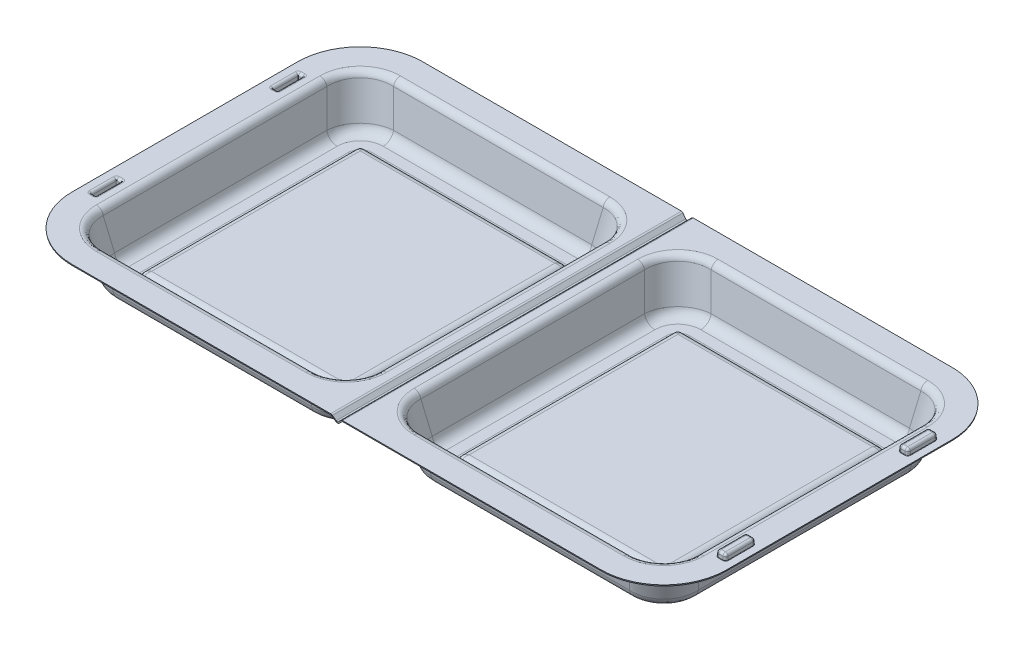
SolidWorks part; units mm, degrees
ref_plane "Front Plane" through (0, 0, 0) normal (0, 0, 1) x (1, 0, 0)
ref_plane "Top Plane" through (0, 0, 0) normal (0, 1, 0) x (1, 0, 0)
ref_plane "Right Plane" through (0, 0, 0) normal (1, 0, 0) x (0, 0, -1)
sketch "Sketch1" plane through (0, 0, 0) normal (0, 1, 0) x (1, 0, 0)
  line L0 (10.16, 80.01) -> (10.16, -80.01)
  line L1 (10.16, 80.01) -> (162.56, 80.01)
  line L2 (162.56, 80.01) -> (162.56, -80.01)
  line L3 (162.56, -80.01) -> (10.16, -80.01)
  line L4 (0, 0) -> (10.16, 0)
  dimension "D1" = 152.4
  dimension "D2" = 160.02
  dimension "D3" = 10.16
extrude "Boss-Extrude1" add sketch "Sketch1" against normal blind 25.4 draft 10 contours L3 L2 L1 L0
fillet "Fillet1" radius 19.05 4 edges at (12.3994, -12.7, 77.7706) (160.3206, -12.7, 77.7706) (160.3206, -12.7, -77.7706) (12.3994, -12.7, -77.7706)
fillet "Fillet2" radius 6.35 8 edges at (20.0997, -25.4, 70.0703) (152.6203, -25.4, 70.0703) (152.6203, -25.4, -70.0703) (20.0997, -25.4, -70.0703) (14.6387, -25.4, 0) (86.36, -25.4, -75.5313) (158.0813, -25.4, 0) (86.36, -25.4, 75.5313)
sketch "Sketch2" plane through (0, -25.4, 0) normal (0, -1, 0) x (1, 0, 0)
  line L8 (32.474, -60.043) -> (140.246, -60.043)
  line L9 (142.593, -57.696) -> (142.593, 57.696)
  line L10 (140.246, 60.043) -> (32.474, 60.043)
  line L11 (30.127, 57.696) -> (30.127, -57.696)
  line L12 (32.474, -60.043) -> (140.246, -60.043)
  line L13 (142.593, -57.696) -> (142.593, 57.696)
  line L14 (140.246, 60.043) -> (32.474, 60.043)
  line L15 (30.127, 57.696) -> (30.127, -57.696)
  spline S0 degree 3 poles (-3932.0247, -594.1817) (747.7764, 130.1973) (23.9409, -23.2816) (30.1943, -58.3085) (30.2357, -58.4592) (30.3472, -58.7486) (30.4164, -58.8857) (30.5826, -59.1443) (30.6811, -59.2671) (30.8994, -59.4859) (31.0191, -59.5826) (31.2793, -59.7509) (31.4193, -59.8217) (48.0334, -66.2502) (141.7104, 114.1395) (-3962.9018, -15.2075) knots -28.65324 -28.65324 -28.65324 -28.65324 0.125 0.125 0.25 0.25 0.375 0.375 0.5 0.5 0.625 0.625 0.75 0.75 15.062828 15.062828 15.062828 15.062828 only from (30.127, -57.696) to (32.474, -60.043)
  spline S1 degree 3 poles (676.7317, -4022.1947) (-47.6473, 657.6064) (105.8316, -66.2291) (140.8585, -59.9757) (141.0092, -59.9343) (141.2986, -59.8228) (141.4357, -59.7536) (141.6943, -59.5874) (141.8171, -59.4889) (142.0359, -59.2706) (142.1326, -59.1509) (142.3009, -58.8907) (142.3717, -58.7507) (148.8002, -42.1366) (-31.5895, 51.5404) (97.7575, -4053.0718) knots -28.65324 -28.65324 -28.65324 -28.65324 0.125 0.125 0.25 0.25 0.375 0.375 0.5 0.5 0.625 0.625 0.75 0.75 15.062828 15.062828 15.062828 15.062828 only from (140.246, -60.043) to (142.593, -57.696)
  spline S2 degree 3 poles (4104.7447, 594.1817) (-575.0564, -130.1973) (148.7791, 23.2816) (142.5257, 58.3085) (142.4843, 58.4592) (142.3728, 58.7486) (142.3036, 58.8857) (142.1374, 59.1443) (142.0389, 59.2671) (141.8206, 59.4859) (141.7009, 59.5826) (141.4407, 59.7509) (141.3007, 59.8217) (124.6866, 66.2502) (31.0096, -114.1395) (4135.6218, 15.2075) knots -28.65324 -28.65324 -28.65324 -28.65324 0.125 0.125 0.25 0.25 0.375 0.375 0.5 0.5 0.625 0.625 0.75 0.75 15.062828 15.062828 15.062828 15.062828 only from (142.593, 57.696) to (140.246, 60.043)
  spline S3 degree 3 poles (-504.0117, 4022.1947) (220.3673, -657.6064) (66.8884, 66.2291) (31.8615, 59.9757) (31.7108, 59.9343) (31.4214, 59.8228) (31.2843, 59.7536) (31.0257, 59.5874) (30.9029, 59.4889) (30.6841, 59.2706) (30.5874, 59.1509) (30.4191, 58.8907) (30.3483, 58.7507) (23.9198, 42.1366) (204.3095, -51.5404) (74.9625, 4053.0718) knots -28.65324 -28.65324 -28.65324 -28.65324 0.125 0.125 0.25 0.25 0.375 0.375 0.5 0.5 0.625 0.625 0.75 0.75 15.062828 15.062828 15.062828 15.062828 only from (32.474, 60.043) to (30.127, 57.696)
  spline S4 degree 3 poles (30.127, -57.696) (30.127, -57.8518) (30.1403, -58.0056) (30.1943, -58.3085) (30.2357, -58.4592) (30.3472, -58.7486) (30.4164, -58.8857) (30.5826, -59.1443) (30.6811, -59.2671) (30.8994, -59.4859) (31.0191, -59.5826) (31.2793, -59.7509) (31.4193, -59.8217) (31.8508, -59.9887) (32.162, -60.043) (32.474, -60.043) knots 0 0 0 0 0.125 0.125 0.25 0.25 0.375 0.375 0.5 0.5 0.625 0.625 0.75 0.75 1 1 1 1
  spline S5 degree 3 poles (140.246, -60.043) (140.4018, -60.043) (140.5556, -60.0297) (140.8585, -59.9757) (141.0092, -59.9343) (141.2986, -59.8228) (141.4357, -59.7536) (141.6943, -59.5874) (141.8171, -59.4889) (142.0359, -59.2706) (142.1326, -59.1509) (142.3009, -58.8907) (142.3717, -58.7507) (142.5387, -58.3192) (142.593, -58.008) (142.593, -57.696) knots 0 0 0 0 0.125 0.125 0.25 0.25 0.375 0.375 0.5 0.5 0.625 0.625 0.75 0.75 1 1 1 1
  spline S6 degree 3 poles (142.593, 57.696) (142.593, 57.8518) (142.5797, 58.0056) (142.5257, 58.3085) (142.4843, 58.4592) (142.3728, 58.7486) (142.3036, 58.8857) (142.1374, 59.1443) (142.0389, 59.2671) (141.8206, 59.4859) (141.7009, 59.5826) (141.4407, 59.7509) (141.3007, 59.8217) (140.8692, 59.9887) (140.558, 60.043) (140.246, 60.043) knots 0 0 0 0 0.125 0.125 0.25 0.25 0.375 0.375 0.5 0.5 0.625 0.625 0.75 0.75 1 1 1 1
  spline S7 degree 3 poles (32.474, 60.043) (32.3182, 60.043) (32.1644, 60.0297) (31.8615, 59.9757) (31.7108, 59.9343) (31.4214, 59.8228) (31.2843, 59.7536) (31.0257, 59.5874) (30.9029, 59.4889) (30.6841, 59.2706) (30.5874, 59.1509) (30.4191, 58.8907) (30.3483, 58.7507) (30.1813, 58.3192) (30.127, 58.008) (30.127, 57.696) knots 0 0 0 0 0.125 0.125 0.25 0.25 0.375 0.375 0.5 0.5 0.625 0.625 0.75 0.75 1 1 1 1
  dimension "D1" = 10.16
extrude "Cut-Extrude1" cut sketch "Sketch2" against normal blind 5.08 draft 10
fillet "Fillet3" radius 5.08 8 edges
fillet "Fillet4" radius 3.175 4 edges at (31.0227, -20.32, 0) (86.36, -20.32, 59.1473) (141.6973, -20.32, 0) (86.36, -20.32, -59.1473)
sketch "Sketch3" plane through (0, 0, 0) normal (0, 1, 0) x (1, 0, 0)
  line L7 (-5.08, 95.25) -> (-5.08, -95.25)
  line L9 (10.16, 61.2494) -> (10.16, -61.2494) construction
  line L10 (143.7994, -95.25) -> (28.9206, -95.25)
  line L11 (177.8, 61.2494) -> (177.8, -61.2494)
  line L12 (28.9206, 95.25) -> (143.7994, 95.25)
  line L13 (143.7994, -95.25) -> (-5.08, -95.25)
  line L14 (177.8, 61.2494) -> (177.8, -61.2494)
  line L15 (-5.08, 95.25) -> (143.7994, 95.25)
  spline S0 degree 3 poles (-1476.3713, -4734.2205) (-318.3363, 251.1803) (198.6543, 41.6712) (176.7289, -70.0564) (176.0868, -72.199) (174.3945, -76.3205) (173.3442, -78.2992) (170.8734, -82.0129) (169.453, -83.7477) (166.2977, -86.903) (164.5629, -88.3234) (160.8492, -90.7942) (158.8705, -91.8445) (154.749, -93.5368) (152.6064, -94.1789) (40.8775, -116.1045) (-168.6349, 400.8978) (4816.9356, 1558.9597) knots -6.149215 -6.149215 -6.149215 -6.149215 0.125 0.125 0.25 0.25 0.375 0.375 0.5 0.5 0.625 0.625 0.75 0.75 0.875 0.875 7.149285 7.149285 7.149285 7.149285 only from (177.8, -61.2494) to (143.7994, -95.25)
  spline S1 degree 3 poles (4816.7705, -1558.9213) (-168.6303, -400.8863) (40.8788, 116.1043) (152.6064, 94.1789) (154.749, 93.5368) (158.8705, 91.8445) (160.8492, 90.7942) (164.5629, 88.3234) (166.2977, 86.903) (169.453, 83.7477) (170.8734, 82.0129) (173.3442, 78.2992) (174.3945, 76.3205) (176.0868, 72.199) (176.7289, 70.0564) (198.6545, -41.6725) (-318.3478, -251.1849) (-1476.4097, 4734.3856) knots -6.149215 -6.149215 -6.149215 -6.149215 0.125 0.125 0.25 0.25 0.375 0.375 0.5 0.5 0.625 0.625 0.75 0.75 0.875 0.875 7.149285 7.149285 7.149285 7.149285 only from (143.7994, 95.25) to (177.8, 61.2494)
  spline S2 degree 3 poles (177.8, -61.2494) (177.8, -63.4693) (177.5855, -65.6915) (176.7289, -70.0564) (176.0868, -72.199) (174.3945, -76.3205) (173.3442, -78.2992) (170.8734, -82.0129) (169.453, -83.7477) (166.2977, -86.903) (164.5629, -88.3234) (160.8492, -90.7942) (158.8705, -91.8445) (154.749, -93.5368) (152.6064, -94.1789) (148.2415, -95.0355) (146.0193, -95.25) (143.7994, -95.25) knots 0 0 0 0 0.125 0.125 0.25 0.25 0.375 0.375 0.5 0.5 0.625 0.625 0.75 0.75 0.875 0.875 1 1 1 1
  spline S3 degree 3 poles (143.7994, 95.25) (146.0193, 95.25) (148.2415, 95.0355) (152.6064, 94.1789) (154.749, 93.5368) (158.8705, 91.8445) (160.8492, 90.7942) (164.5629, 88.3234) (166.2977, 86.903) (169.453, 83.7477) (170.8734, 82.0129) (173.3442, 78.2992) (174.3945, 76.3205) (176.0868, 72.199) (176.7289, 70.0564) (177.5855, 65.6915) (177.8, 63.4693) (177.8, 61.2494) knots 0 0 0 0 0.125 0.125 0.25 0.25 0.375 0.375 0.5 0.5 0.625 0.625 0.75 0.75 0.875 0.875 1 1 1 1
  dimension "D2" = 15.24
  dimension "D1" = 15.24
extrude "Boss-Extrude2" add sketch "Sketch3" along normal blind 10.16 draft 10
fillet "Fillet5" radius 3.175 8 edges at (157.099, 0, 74.549) (162.56, 0, 0) (157.099, 0, -74.549) (86.36, 0, -80.01) (15.621, 0, -74.549) (10.16, 0, 0) (15.621, 0, 74.549) (86.36, 0, 80.01)
sketch "Sketch4" plane through (0, 0, 0) normal (0, 0, 1) x (1, 0, 0)
  line L0 (0, 0) -> (0, -2.9972)
  line L1 (0, -2.9972) -> (2.9972, 0)
  line L2 (-5.08, 0) -> (143.7994, 0) construction
  line L3 (2.9972, 0) -> (0, 0)
  dimension "D1" = 2.9972
  dimension "D2" = 45
extrude "Boss-Extrude3" add sketch "Sketch4" along normal up to surface and the other way up to surface
mirror "Mirror1" about plane through (0, 0, 0) normal (1, 0, 0)
sketch "Sketch5" plane through (0, 0, 0) normal (0, 1, 0) x (1, 0, 0)
  line L0 (0, 0) -> (205.0671, 0) construction
  line L1 (169.1775, 57.15) -> (169.1775, 41.91)
  line L2 (173.2415, -57.15) -> (169.1775, -57.15)
  line L3 (173.2415, -57.15) -> (173.2415, -41.91)
  line L4 (173.2415, -41.91) -> (169.1775, -41.91)
  line L5 (169.1775, -57.15) -> (169.1775, -41.91)
  line L6 (173.2415, 41.91) -> (169.1775, 41.91)
  line L7 (173.2415, 57.15) -> (173.2415, 41.91)
  line L8 (173.2415, 57.15) -> (169.1775, 57.15)
  line L10 (179.5915, -61.2494) -> (179.5915, 61.2494) construction
  dimension "D1" = 15.24
  dimension "D2" = 41.91
  dimension "D3" = 6.35
  dimension "D4" = 4.064
extrude "Cut-Extrude3" cut sketch "Sketch5" along normal blind 3.175 draft 3
sketch "Sketch6" plane through (0, 0, 0) normal (0, -1, 0) x (1, 0, 0)
  line L0 (0, 0) -> (-198.0596, 0) construction
  line L1 (-173.1145, -56.896) -> (-173.1145, -41.91)
  line L2 (-169.3045, 56.896) -> (-173.1145, 56.896)
  line L3 (-169.3045, 56.896) -> (-169.3045, 41.91)
  line L4 (-169.3045, 41.91) -> (-173.1145, 41.91)
  line L5 (-173.1145, 56.896) -> (-173.1145, 41.91)
  line L6 (-169.3045, -56.896) -> (-169.3045, -41.91)
  line L7 (-169.3045, -56.896) -> (-173.1145, -56.896)
  line L8 (-169.3045, -41.91) -> (-173.1145, -41.91)
  line L10 (-179.5915, 61.2494) -> (-179.5915, -61.2494) construction
  dimension "D1" = 3.81
  dimension "D2" = 6.477
  dimension "D3" = 41.91
  dimension "D4" = 14.986
extrude "Boss-Extrude4" add sketch "Sketch6" along normal blind 3.556 draft 3
fillet "Fillet6" radius 0.8128 48 edges at (173.2415, 0, 49.53) (173.1583, 1.5875, 57.0668) (171.2095, 0, 41.91) (173.1583, 1.5875, 41.9932) (169.1775, 0, 49.53) (169.2607, 1.5875, 41.9932) (171.2095, 0, 57.15) (169.2607, 1.5875, 57.0668) (173.0751, 3.175, 49.53) (171.2095, 3.175, 42.0764) (169.3439, 3.175, 49.53) (171.2095, 3.175, 56.9836) (171.2095, 0, -57.15) (173.1583, 1.5875, -57.0668) (169.1775, 0, -49.53) (169.2607, 1.5875, -57.0668) (171.2095, 0, -41.91) (169.2607, 1.5875, -41.9932) (173.2415, 0, -49.53) (173.1583, 1.5875, -41.9932) (171.2095, 3.175, -56.9836) (169.3439, 3.175, -49.53) (171.2095, 3.175, -42.0764) (173.0751, 3.175, -49.53) (-169.3045, 0, 49.403) (-169.3977, -1.778, 42.0032) (-171.2095, 0, 56.896) (-169.3977, -1.778, 56.8028) (-173.1145, 0, 49.403) (-173.0213, -1.778, 56.8028) (-171.2095, 0, 41.91) (-173.0213, -1.778, 42.0032) (-169.4908, -3.556, 49.403) (-171.2095, -3.556, 56.7096) (-172.9281, -3.556, 49.403) (-171.2095, -3.556, 42.0964) (-171.2095, 0, -56.896) (-173.0213, -1.778, -56.8028) (-169.3045, 0, -49.403) (-169.3977, -1.778, -56.8028) (-171.2095, 0, -41.91) (-169.3977, -1.778, -42.0032) (-173.1145, 0, -49.403) (-173.0213, -1.778, -42.0032) (-171.2095, -3.556, -56.7096) (-169.4908, -3.556, -49.403) (-171.2095, -3.556, -42.0964) (-172.9281, -3.556, -49.403)
shell "Shell1" thickness 0.635
fillet "Fillet8" radius 1.27 3 edges at (0, -2.9972, 0) (2.7342, 0.635, 0) (-2.7342, 0.635, 0)
fillet "Fillet9" radius 0.8128 3 edges at (2.9972, 0, 0) (-2.9972, 0, 0) (0, -2.0992, 0)
